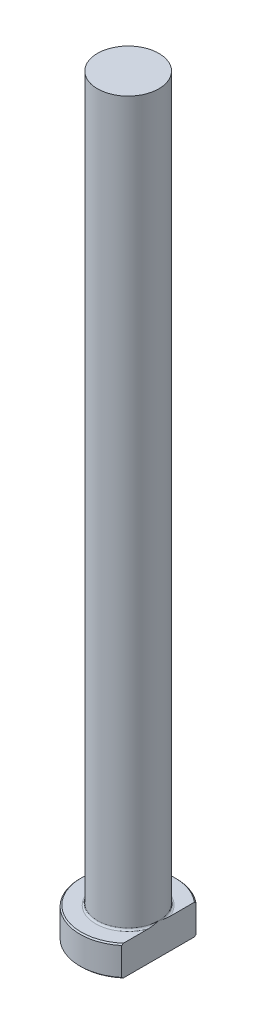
SolidWorks part; units mm, degrees
ref_plane "Front Plane" through (0, 0, 0) normal (0, 0, 1) x (1, 0, 0)
ref_plane "Top Plane" through (0, 0, 0) normal (0, 1, 0) x (1, 0, 0)
ref_plane "Right Plane" through (0, 0, 0) normal (1, 0, 0) x (0, 0, -1)
sketch "Sketch1" plane through (0, 0, 0) normal (0, 0, 1) x (1, 0, 0)
  line L0 (0, 259.9588) -> (0, -15.1925) construction
  line L1 (0, 0) -> (-8, 0)
  line L2 (-8, 0) -> (-8, 5)
  line L3 (-8, 5) -> (-5.1, 5)
  line L4 (-5.1, 5) -> (-5.1, 125)
  line L5 (-5.1, 125) -> (0, 125)
  line L6 (0, 125) -> (0, 0)
  dimension "L" = 125
  dimension "H" = 16
  dimension "T" = 5
  dimension "D" = 10.2
revolve "Revolve1" add sketch "Sketch1" angle 360 about L0
chamfer "Chamfer1" distance 0.2 angle 45 2 edges at (0, 5, 8) (0, 0, 8)
fillet "Fillet1" radius 0.3 1 edges at (0, 5, 5.1)
sketch "Sketch2" plane through (0, 0, 0) normal (0, 1, 0) x (1, 0, 0)
  line L0 (5.1, 6.1636) -> (5.1, -6.1636)
  circle A0 centre (0, 0) radius 8 construction
  arc A1 (5.1, -6.1636) -> (5.1, 6.1636) centre (0, 0) ccw
  circle A2 centre (0, 0) radius 5.1 construction
extrude "KEY" cut sketch "Sketch2" along normal through all
